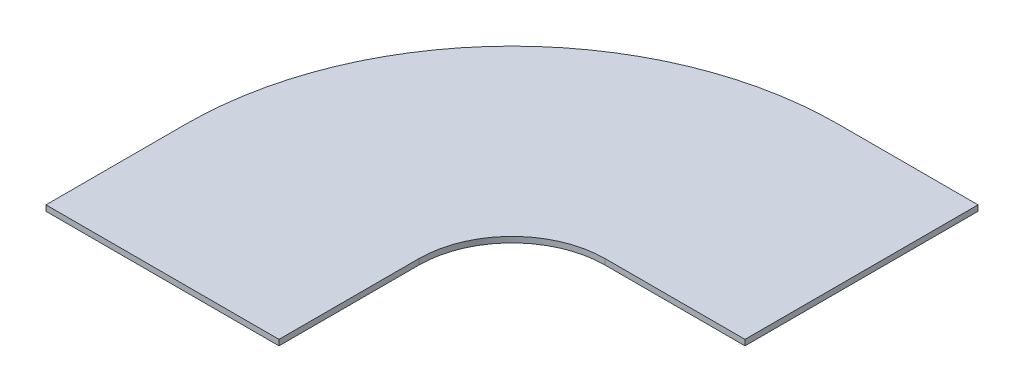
SolidWorks part; units mm, degrees
ref_plane "Front Plane" through (0, 0, 0) normal (0, 0, 1) x (1, 0, 0)
ref_plane "Top Plane" through (0, 0, 0) normal (0, 1, 0) x (1, 0, 0)
ref_plane "Right Plane" through (0, 0, 0) normal (1, 0, 0) x (0, 0, -1)
sketch "Sketch1" plane through (0, 0, 0) normal (0, 1, 0) x (1, 0, 0)
  line L0 (0, 0) -> (0, 30)
  line L1 (70, 100) -> (100, 100)
  line L2 (100, 100) -> (100, 50)
  line L3 (100, 50) -> (70, 50)
  line L4 (50, 30) -> (50, 0)
  line L5 (50, 0) -> (0, 0)
  arc A0 (0, 30) -> (70, 100) centre (70, 30) cw
  arc A1 (70, 50) -> (50, 30) centre (70, 30) ccw
  dimension "D3" = 20
  dimension "D1" = 30
  dimension "D2" = 50
sheet metal parameters "Sheet-Metal1" thickness 1.2141 parameters "D1"=1.27
base flange "Base-Flange1" sketch "Sketch1" thickness 1.2141 reverse thickness direction yes parameters "D1"=1.27
flat pattern "Flat-Pattern1"
sketch "Bend-Lines1" plane through (0, 0, 0) normal (0, 1, 0) x (-1, 0, 0)
